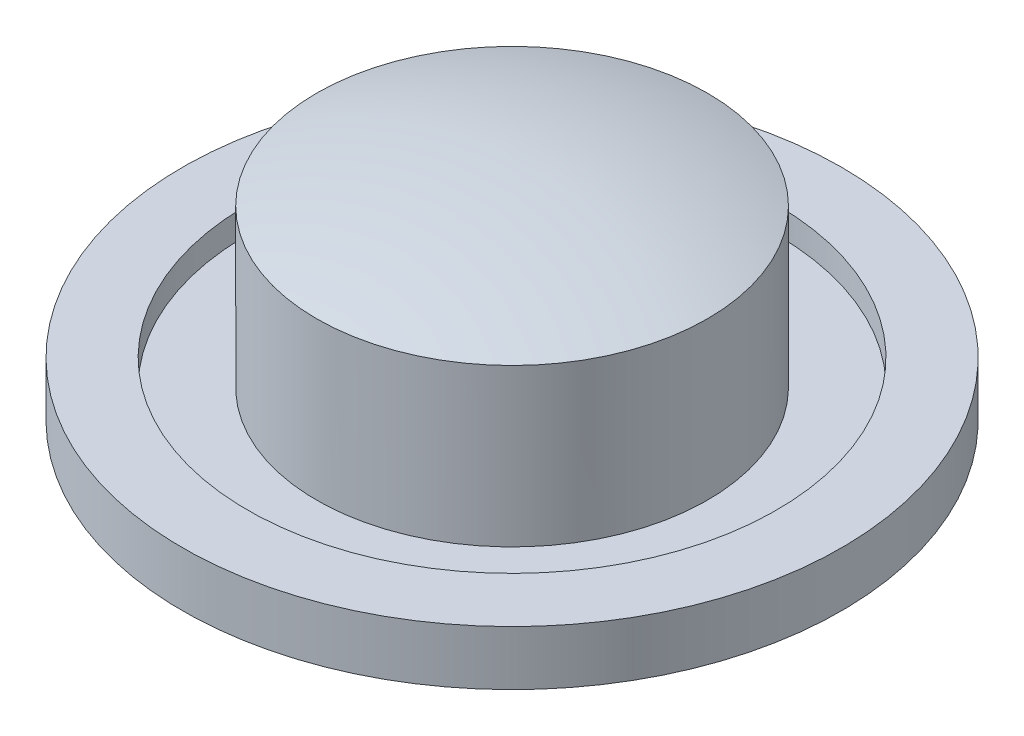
SolidWorks part; units mm, degrees
ref_plane "Front Plane" through (0, 0, 0) normal (0, 0, 1) x (1, 0, 0)
ref_plane "Top Plane" through (0, 0, 0) normal (0, 1, 0) x (1, 0, 0)
ref_plane "Right Plane" through (0, 0, 0) normal (1, 0, 0) x (0, 0, -1)
sketch "Sketch1" plane through (0, 0, 0) normal (0, 0, 1) x (1, 0, 0)
  line L0 (0, 0) -> (0, 43.8386) construction
  line L1 (0, 43.8386) -> (-18.6506, 43.8386) construction
  line L2 (39.224, 37.3013) -> (39.224, 5.7682)
  line L3 (39.224, 5.7682) -> (53.0678, 5.7682)
  line L4 (53.0678, 5.7682) -> (53.0678, 10.9597)
  line L5 (53.0678, 10.9597) -> (66.1425, 10.9597)
  line L6 (66.1425, 10.9597) -> (66.1425, 0)
  line L7 (66.1425, 0) -> (0, 0)
  line L8 (0, 0) -> (0, 43.8386)
  arc A0 (0, 43.8386) -> (39.224, 37.3013) centre (0, -77.1021) cw
revolve "Revolve1" add sketch "Sketch1" angle 360 about L8
